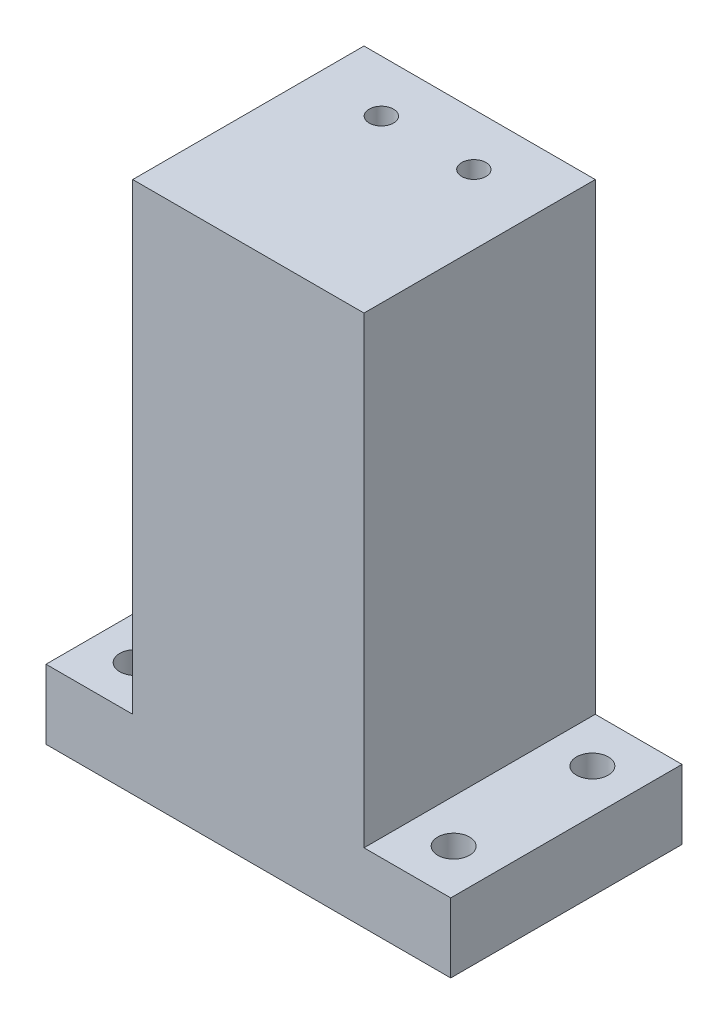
SolidWorks part; units mm, degrees
ref_plane "前视基准面" through (0, 0, 0) normal (0, 0, 1) x (1, 0, 0)
ref_plane "上视基准面" through (0, 0, 0) normal (0, 1, 0) x (1, 0, 0)
ref_plane "右视基准面" through (0, 0, 0) normal (1, 0, 0) x (0, 0, -1)
sketch "草图1" plane through (0, 0, 0) normal (0, 0, 1) x (1, 0, 0)
  line L0 (15, 12) -> (15, 92.1)
  line L1 (55, 12) -> (55, 92.1)
  line L2 (0, 0) -> (0, 12)
  line L3 (70, 0) -> (70, 12)
  line L4 (15, 92.1) -> (55, 92.1)
  line L5 (0, 0) -> (70, 0)
  line L6 (0, 12) -> (15, 12)
  line L7 (55, 12) -> (70, 12)
extrude "凸台-拉伸1" add sketch "草图1" along normal blind 40
sketch "草图2" plane through (0, 12, 0) normal (0, 1, 0) x (1, 0, 0)
  circle A0 centre (62.5, -8) radius 2.75
  circle A1 centre (62.5, -32) radius 2.75
  circle A2 centre (7.5, -32) radius 2.75
  circle A3 centre (7.5, -8) radius 2.75
extrude "切除-拉伸1" cut sketch "草图2" against normal blind 40
sketch "草图3" plane through (0, 92.1, 0) normal (0, 1, 0) x (1, 0, 0)
  circle A0 centre (27, -9) radius 2.1
  circle A1 centre (43, -9) radius 2.1
extrude "切除-拉伸2" cut sketch "草图3" against normal blind 15
